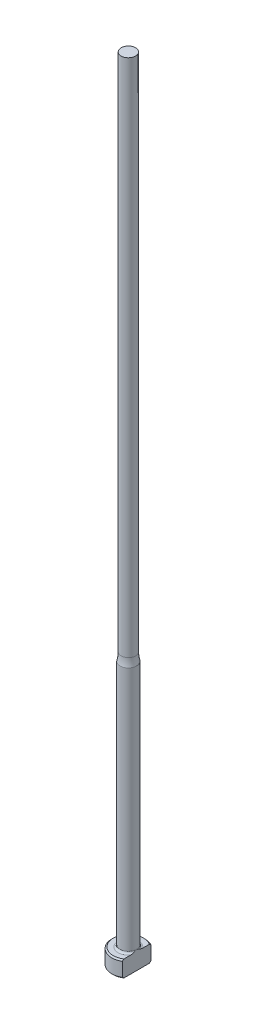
SolidWorks part; units mm, degrees
ref_plane "Front Plane" through (0, 0, 0) normal (0, 0, 1) x (1, 0, 0)
ref_plane "Top Plane" through (0, 0, 0) normal (0, 1, 0) x (1, 0, 0)
ref_plane "Right Plane" through (0, 0, 0) normal (1, 0, 0) x (0, 0, -1)
sketch "Sketch1" plane through (0, 0, 0) normal (0, 0, 1) x (1, 0, 0)
  line L0 (0, 259.9588) -> (0, -15.1925) construction
  line L1 (0, 0) -> (-3.175, 0)
  line L2 (-3.175, 0) -> (-3.175, 3.175)
  line L3 (-3.175, 3.175) -> (-1.5875, 3.175)
  line L4 (-1.3881, 52.3788) -> (-1.3881, 152.4)
  line L5 (-1.3881, 152.4) -> (0, 152.4)
  line L6 (0, 152.4) -> (0, 0)
  line L7 (-1.5875, 3.175) -> (-1.5875, 50.8)
  arc A0 (-1.5875, 50.8) -> (-1.3881, 52.3788) centre (-7.7381, 52.3788) ccw
  point P13 (-1.5875, 0)
  dimension "D1" = 6.35
  dimension "L" = 152.4
  dimension "D2" = 3.175
  dimension "H" = 6.35
  dimension "T" = 3.175
  dimension "D" = 2.7762
  dimension "S" = 50.8
revolve "Revolve1" add sketch "Sketch1" angle 360 about L0
chamfer "Chamfer1" distance 0.254 angle 45 2 edges at (0, 3.175, 3.175) (0, 0, 3.175)
fillet "Fillet1" radius 0.381 1 edges at (0, 3.175, 1.5875)
sketch "Sketch2" plane through (0, 0, 0) normal (0, 1, 0) x (1, 0, 0)
  line L0 (1.5875, -2.7496) -> (1.5875, 2.7496)
  circle A0 centre (0, 0) radius 3.175 construction
  arc A2 (1.5875, -2.7496) -> (1.5875, 2.7496) centre (0, 0) ccw
  circle A3 centre (0, 0) radius 3.175 construction
  circle A4 centre (0, 0) radius 1.5875 construction
extrude "Key Head" cut sketch "Sketch2" along normal up to next
